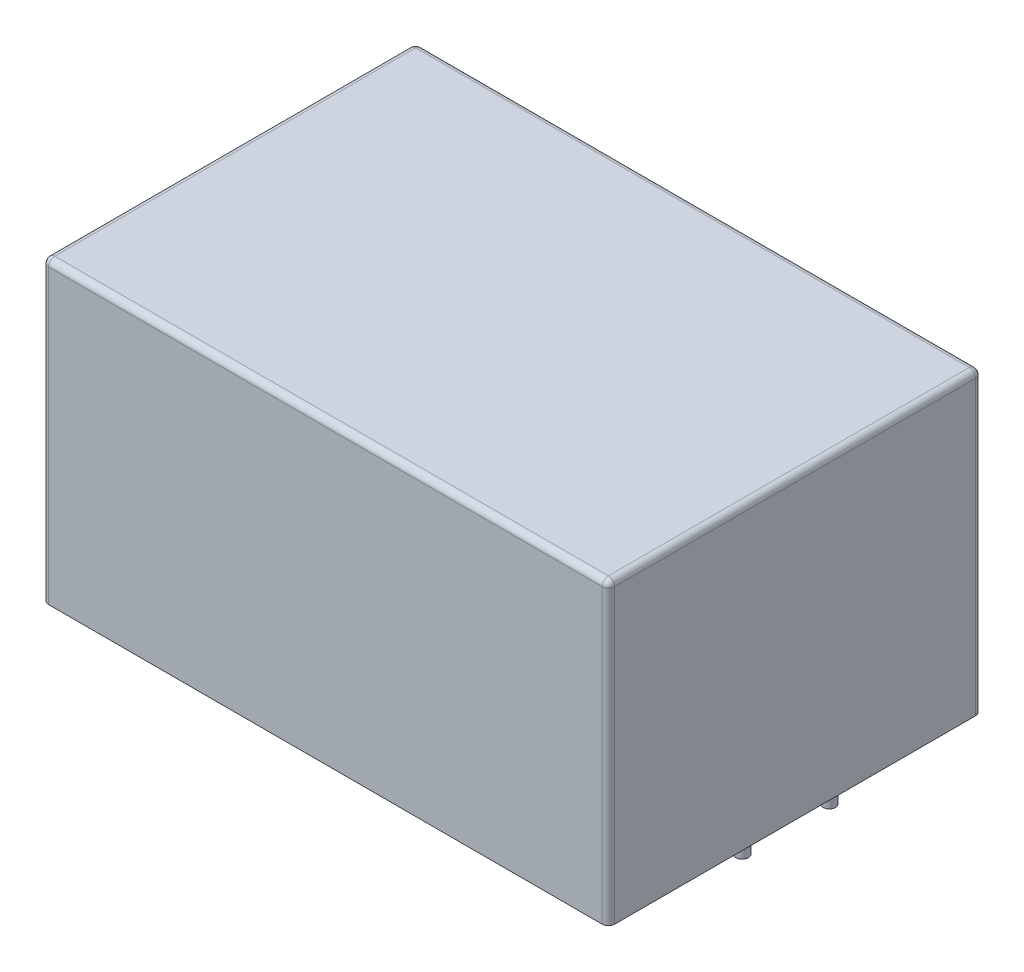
SolidWorks part; units mm, degrees
ref_plane "Front Plane" through (0, 0, 0) normal (0, 0, 1) x (1, 0, 0)
ref_plane "Top Plane" through (0, 0, 0) normal (0, 1, 0) x (1, 0, 0)
ref_plane "Right Plane" through (0, 0, 0) normal (1, 0, 0) x (0, 0, -1)
sketch "Sketch1" plane through (0, 0, 0) normal (0, 1, 0) x (1, 0, 0)
  line L1 (22.75, 15) -> (-22.75, 15)
  line L2 (22.75, 15) -> (22.75, -15)
  line L3 (22.75, -15) -> (-22.75, -15)
  line L4 (-22.75, 15) -> (-22.75, -15)
  line L5 (22.75, 15) -> (-22.75, -15) construction
  line L6 (22.75, -15) -> (-22.75, 15) construction
  point P0 (0, 0)
  dimension "D1" = 45.5
  dimension "D2" = 30
extrude "Boss-Extrude1" add sketch "Sketch1" along normal blind 24
fillet "Fillet1" radius 0.5 8 edges at (0, 24, -15) (22.75, 24, 0) (0, 24, 15) (-22.75, 24, 0) (22.75, 12, -15) (-22.75, 12, -15) (-22.75, 12, 15) (22.75, 12, 15)
sketch "Sketch2" plane through (0, 0, 0) normal (0, -1, 0) x (-1, 0, 0)
  line L0 (19.5, -6) -> (19.5, 6) construction
  line L1 (19.5, 6) -> (-19.5, 6) construction
  line L2 (-19.5, 6) -> (-19.5, -1) construction
  line L3 (19.5, 0) -> (0, 0) construction
  circle A0 centre (19.5, -6) radius 0.5
  circle A1 centre (19.5, 6) radius 0.5
  circle A2 centre (-19.5, -1) radius 0.5
  circle A3 centre (-19.5, 6) radius 0.5
  point P11 (0, 6)
extrude "Boss-Extrude2" add sketch "Sketch2" along normal blind 3.5
equation "\"D2@Sketch2\"=\"D1@Sketch2\""
equation "\"D3@Sketch2\"=\"D1@Sketch2\""
equation "\"D4@Sketch2\"=\"D1@Sketch2\""
